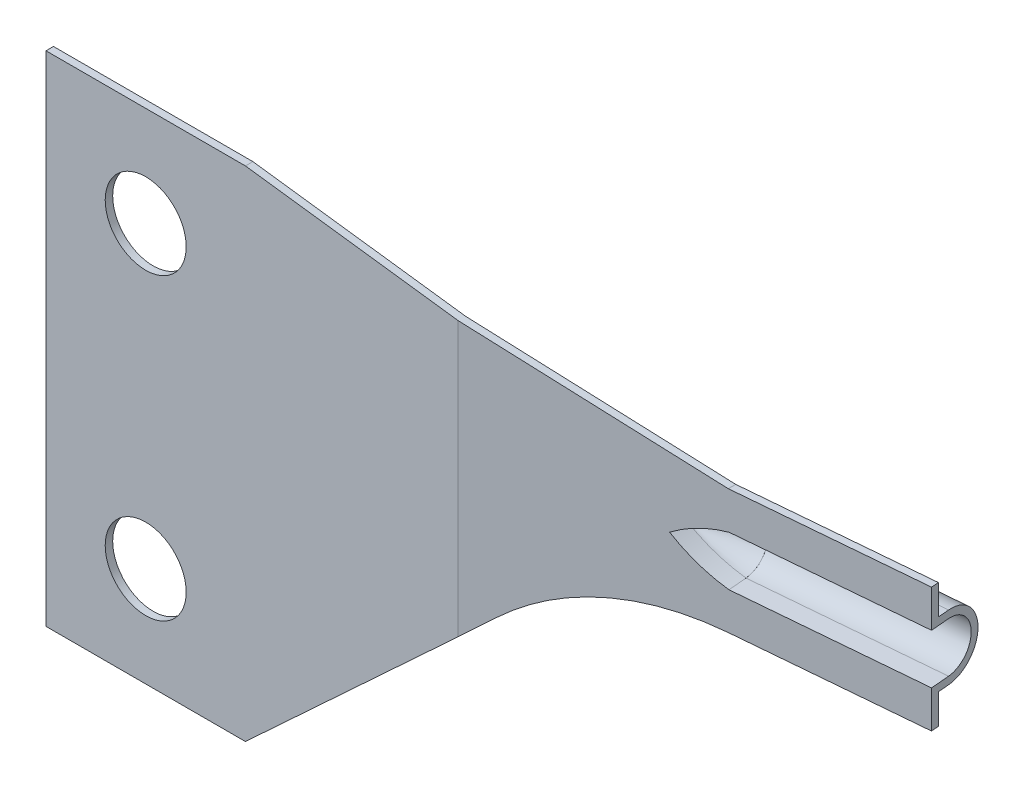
SolidWorks part; units mm, degrees
ref_plane "Plan1" through (0, 0, 0) normal (0, 0, 1) x (1, 0, 0)
ref_plane "Plan2" through (0, 0, 0) normal (0, 1, 0) x (1, 0, 0)
ref_plane "Plan3" through (0, 0, 0) normal (1, 0, 0) x (0, 0, -1)
sketch "Esquisse2" plane through (0, 0, 0) normal (0, 0, 1) x (1, 0, 0)
  line L0 (0, 0) -> (16, 0)
  line L1 (0, 0) -> (0, 40)
  line L2 (0, 40) -> (16, 40)
  line L4 (8, 40) -> (8, 0) construction
  line L5 (0, 32) -> (16, 32) construction
  line L6 (0, 8) -> (16, 8) construction
  line L7 (0, 30.2) -> (60, 30.2) construction
  line L8 (68, 35.2) -> (68, 25.2)
  line L9 (53, 30.2) -> (53, -10) construction
  line L11 (68, 25.2) -> (53, 25.2)
  line L12 (68, 35.2) -> (53, 35.2)
  line L13 (16, 40) -> (53, 35.2)
  line L14 (16, 0) -> (36.009, 18.5386)
  circle A0 centre (8, 32) radius 3.25
  circle A1 centre (8, 8) radius 3.25
  arc A2 (53, 25.2) -> (36.009, 18.5386) centre (53, 0.2) ccw
  dimension "D9" = 6.5
  dimension "D10" = 6.5
  dimension "D13" = 50
  dimension "D1" = 40
  dimension "D3" = 8
  dimension "D4" = 24
  dimension "D5" = 1.8
  dimension "D6" = 5
  dimension "D7" = 5
  dimension "D8" = 60
  dimension "D11" = 45
extrude "Base-Extrusion" add sketch "Esquisse2" along normal blind 10
sketch "Esquisse3" plane through (0, 0, 0) normal (0, 1, 0) x (1, 0, 0)
  line L0 (-11.4056, -10) -> (33.0764, -10)
  line L1 (70.1112, 7.4183) -> (71.2901, -6.0567)
  line L2 (-11.0611, -9.4) -> (33.0764, -9.4)
  line L3 (0.0764, 10) -> (-11.0611, -9.4)
  line L4 (10.2402, -30.6304) -> (73.0225, -25.8575)
  line L5 (71.3422, -6.6522) -> (73.0225, -25.8575)
  line L6 (33.0764, -10) -> (71.3422, -6.6522)
  line L7 (33.0764, -9.4) -> (71.2901, -6.0567)
  line L8 (53, -10) -> (68, -10) construction
  line L9 (10.2402, -30.6304) -> (-14.9478, -16.17)
  line L10 (0.0764, 10) -> (70.1112, 7.4183)
  line L12 (-11.4056, -10) -> (-14.9478, -16.17)
  dimension "D1" = 0.6
  dimension "D2" = 5
extrude "Enlèv. mat.-Extru.2" cut sketch "Esquisse3" along normal through all
sketch "Esquisse4" plane through (0, 25.2, 0) normal (0, -1, 0) x (1, 0, 0)
  line L0 (68, 6.9446) -> (67.7831, 4.4649)
  line L1 (68, 6.3446) -> (53, 7.6569) construction
  line L2 (68, 6.9446) -> (68.4456, 6.9056)
  line L3 (68.4456, 6.9056) -> (67.7831, 4.4649)
extrude "Enlèv. mat.-Extru.4" cut sketch "Esquisse4" against normal through all
sketch "Esquisse5" plane through (66.8805, 0, -5.8513) normal (0.9962, 0, -0.0872) x (-0.0872, 0, -0.9962)
  line L2 (-12.8447, 25.2) -> (-12.8447, 35.2) construction
  line L3 (-12.247, 28.2) -> (-12.247, 27.6)
  line L4 (-12.247, 32.8) -> (-12.247, 32.2)
  line L6 (-12.5459, 35.5517) -> (-12.5459, 24.96) construction
  line L7 (-11.3447, 27.6) -> (-12.247, 27.6)
  line L8 (-11.3447, 32.8) -> (-12.247, 32.8)
  line L9 (-12.247, 32.2) -> (-11.3447, 32.2)
  line L10 (-12.247, 28.2) -> (-11.3447, 28.2)
  arc A2 (-11.3447, 32.8) -> (-11.3447, 27.6) centre (-11.3447, 30.2) cw
  arc A3 (-11.3447, 32.2) -> (-11.3447, 28.2) centre (-11.3447, 30.2) cw
  point P20 (-12.5459, 32.2)
  point P23 (-12.5459, 25.6271)
  point P27 (-12.5459, 34.95)
  point P28 (-12.5459, 28.2)
extrude "Boss.-Extru.1" add sketch "Esquisse5" against normal blind 15
ref_plane "Plan4" through (0, 30.2, 0) normal (0, 1, 0) x (-1, 0, 0)
sketch "Esquisse13" plane through (66.8805, 0, -5.8513) normal (0.9962, 0, -0.0872) x (-0.0872, 0, -0.9962)
  line L0 (-12.247, 32.2) -> (-12.8447, 32.2)
  line L1 (-12.247, 28.2) -> (-12.8447, 28.2)
  line L2 (-12.247, 32.2) -> (-12.247, 28.2)
  line L3 (-12.8447, 32.2) -> (-12.8447, 28.2)
  line L4 (-12.8447, 25.2) -> (-12.8447, 35.2) construction
  line L5 (-12.247, 32.8) -> (-12.247, 35.2) construction
extrude "Enlèv. mat.-Extru.10" cut sketch "Esquisse13" against normal blind 15
ref_plane "Plan5" through (0, 30.2, 0) normal (0, 1, 0) x (-1, 0, 0)
sketch "Esquisse14" plane through (0, 30.2, 0) normal (0, 1, 0) x (-1, 0, 0)
  line L0 (-52.6997, 4.1675) -> (-52.9263, 6.7576) construction
  line L1 (-52.6999, 4.1693) -> (-52.7522, 4.767)
  line L2 (-52.752, 4.7652) -> (-52.9263, 6.7576) construction
  line L3 (-56.3867, 6.4549) -> (-38.0764, 8.0568) construction
  line L5 (-48.5431, 7.1411) -> (-47.9454, 7.1934)
  line L8 (-52.9263, 6.7576) -> (-67.8693, 5.4503) construction
  arc A0 (-47.9454, 7.1934) -> (-52.6999, 4.1693) centre (-56.9949, 16.1714) cw
  arc A1 (-48.5431, 7.1411) -> (-52.7522, 4.767) centre (-56.1367, 15.6857) cw
  dimension "D1" = 0.5977
  dimension "D2" = 0.6
  dimension "D3" = 0.6
revolve "Boss.-Révol.2" add sketch "Esquisse14" angle 90 about L3
pattern_circular "Répétition circulaire2" count 2 every 90 about axis through (56.3867, 30.2, 6.4549) along (-0.9962, 0, 0.0872)
sketch "Esquisse15" plane through (1.1195, 0, 12.7959) normal (0.0872, 0, 0.9962) x (0.9962, 0, -0.0872)
  line L0 (52.136, 32.1982) -> (52.136, 28.2018)
  arc A0 (47.736, 30.2) -> (52.136, 28.2018) centre (54.556, 39.3739) ccw
  arc A1 (52.136, 32.1982) -> (47.736, 30.2) centre (54.556, 21.0261) ccw
  arc A2 (52.136, 32.1982) -> (47.736, 30.2) centre (54.556, 21.0261) ccw construction
  arc A3 (47.736, 30.2) -> (52.136, 28.2018) centre (54.556, 39.3739) ccw construction
extrude "Enlèv. mat.-Extru.11" cut sketch "Esquisse15" against normal up to surface (0.5977 mm away)
sketch "Esquisse17" plane through (1.0674, 0, 12.2004) normal (-0.0872, 0, -0.9962) x (-0.9962, 0, 0.0872)
  line L0 (-52.136, 32.7982) -> (-52.136, 32.1982)
  line L1 (-52.136, 28.2018) -> (-52.136, 27.6018)
  arc A1 (-47.136, 30.2) -> (-52.136, 32.7982) centre (-55.3686, 20.4674) ccw
  arc A4 (-52.136, 28.2018) -> (-47.736, 30.2) centre (-54.556, 39.3739) ccw
  arc A5 (-52.136, 27.6018) -> (-47.136, 30.2) centre (-55.3686, 39.9326) ccw
  arc A6 (-52.136, 27.6018) -> (-47.136, 30.2) centre (-55.3686, 39.9326) ccw construction
  arc A7 (-52.136, 28.2018) -> (-47.736, 30.2) centre (-54.556, 39.3739) ccw construction
  arc A9 (-47.736, 30.2) -> (-52.136, 32.1982) centre (-54.556, 21.0261) ccw
extrude "Boss.-Extru.4" add sketch "Esquisse17" along normal up to surface (0.9023 mm away)
